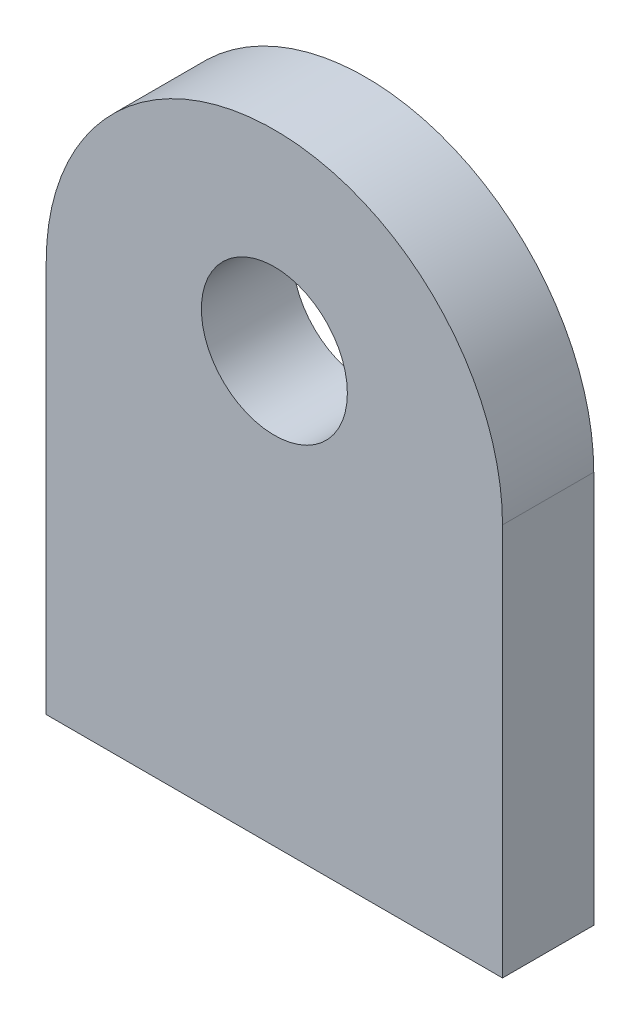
SolidWorks part; units mm, degrees
ref_plane "Plan de face" through (0, 0, 0) normal (0, 0, 1) x (1, 0, 0)
ref_plane "Plan de dessus" through (0, 0, 0) normal (0, 1, 0) x (1, 0, 0)
ref_plane "Plan de droite" through (0, 0, 0) normal (1, 0, 0) x (0, 0, -1)
sketch "Esquisse1" plane through (0, 0, 0) normal (0, 0, 1) x (1, 0, 0)
  line L0 (-12.5, 0) -> (12.5, 0)
  line L1 (12.5, 0) -> (12.5, 21.5)
  line L2 (-12.5, 21.5) -> (-12.5, 0)
  arc A0 (12.5, 21.5) -> (-12.5, 21.5) centre (0, 21.5) ccw
  point P6 (0, 0)
  dimension "D2" = 34
  dimension "D1" = 25
extrude "Boss.-Extru.1" add sketch "Esquisse1" along normal blind 5
sketch "Esquisse4" plane through (0, 0, 5) normal (0, 0, 1) x (1, 0, 0)
  circle A0 centre (0, 23.5) radius 4
  dimension "D1" = 8
  dimension "D2" = 2
extrude "Enlèv. mat.-Extru.1" cut sketch "Esquisse4" against normal through all
